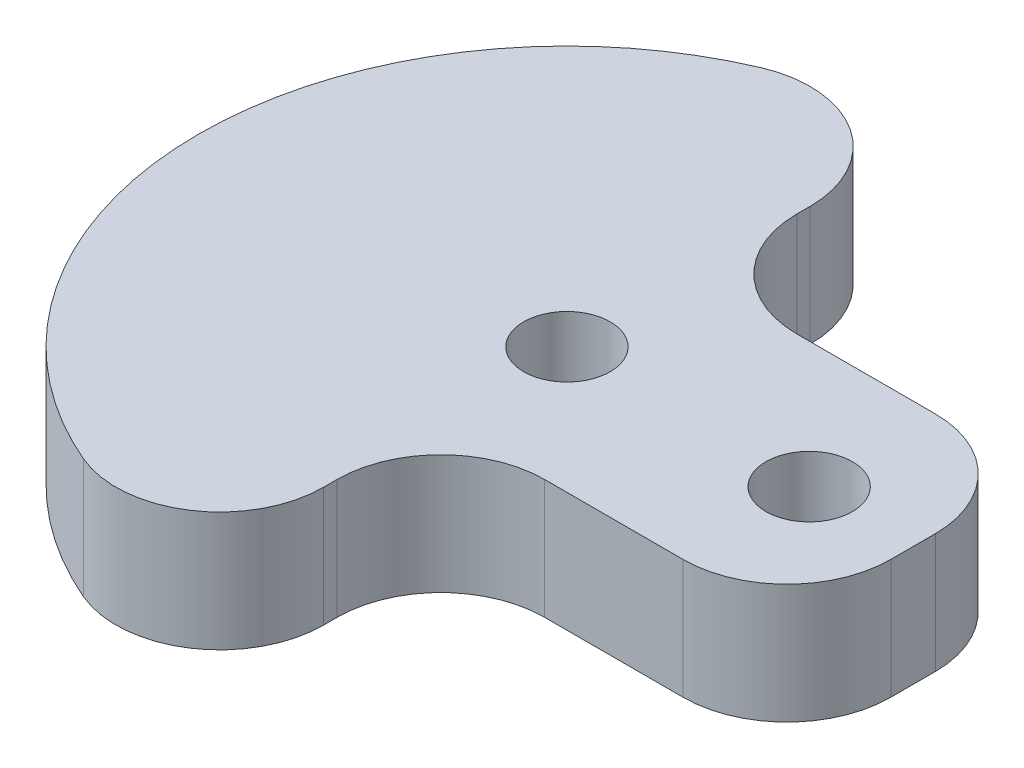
SolidWorks part; units mm, degrees
ref_plane "Front Plane" through (0, 0, 0) normal (0, 0, 1) x (1, 0, 0)
ref_plane "Top Plane" through (0, 0, 0) normal (0, 1, 0) x (1, 0, 0)
ref_plane "Right Plane" through (0, 0, 0) normal (1, 0, 0) x (0, 0, -1)
sketch "Sketch1" plane through (0, 0, 0) normal (0, 1, 0) x (1, 0, 0)
  line L0 (0, 17.8548) -> (0, 16.8729)
  line L1 (7.62, 9.2529) -> (17.78, 9.2529)
  line L2 (25.4, 1.6329) -> (25.4, -1.6329)
  line L3 (17.78, -9.2529) -> (7.62, -9.2529)
  line L4 (0, -16.8729) -> (0, -17.8548)
  circle A0 centre (0, 0) radius 3.175
  circle A1 centre (17.78, 0) radius 3.175
  circle A2 centre (0, 0) radius 27.0329 construction
  arc A3 (-10.611, -24.8633) -> (-10.611, 24.8633) centre (0, 0) cw
  arc A4 (7.62, -9.2529) -> (0, -16.8729) centre (7.62, -16.8729) ccw
  arc A5 (-10.611, -24.8633) -> (0, -17.8548) centre (-7.62, -17.8548) ccw
  arc A6 (25.4, -1.6329) -> (17.78, -9.2529) centre (17.78, -1.6329) cw
  arc A7 (17.78, 9.2529) -> (25.4, 1.6329) centre (17.78, 1.6329) cw
  arc A8 (0, 16.8729) -> (7.62, 9.2529) centre (7.62, 16.8729) ccw
  arc A9 (-10.611, 24.8633) -> (0, 17.8548) centre (-7.62, 17.8548) cw
  point P14 (0, -9.2529)
  point P17 (0, -27.0329)
  point P20 (25.4, -9.2529)
  point P23 (25.4, 9.2529)
  dimension "D1" = 17.78
  dimension "D2" = 7.62
  dimension "D3" = 17.78
  dimension "D4" = 25.4
extrude "Boss-Extrude2" add sketch "Sketch1" along normal blind 8.763
